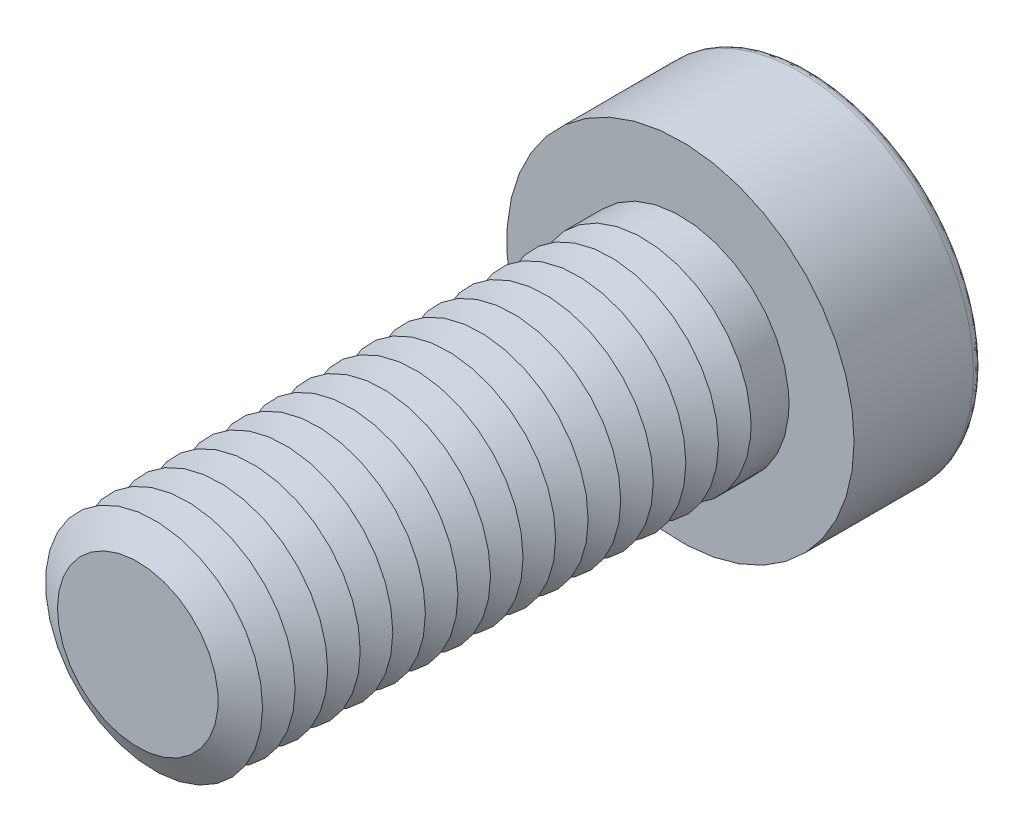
SolidWorks part; units mm, degrees
ref_plane "Front Plane" through (0, 0, 0) normal (0, 0, 1) x (1, 0, 0)
ref_plane "Top Plane" through (0, 0, 0) normal (0, 1, 0) x (1, 0, 0)
ref_plane "Right Plane" through (0, 0, 0) normal (1, 0, 0) x (0, 0, -1)
sketch "Sketch1" plane through (0, 0, 0) normal (0, 0, 1) x (1, 0, 0)
  circle A0 centre (0, 0) radius 5
  dimension "D1" = 10
extrude "Boss-Extrude1" add sketch "Sketch1" along normal blind 25
sketch "Sketch2" plane through (0, 0, 0) normal (0, 0, -1) x (-1, 0, 0)
  circle A0 centre (0, 0) radius 8
  dimension "D1" = 16
extrude "Boss-Extrude2" add sketch "Sketch2" along normal blind 6
sketch "Sketch3" plane through (0, 0, -6) normal (0, 0, -1) x (-1, 0, 0)
  line L1 (-2.0207, 3.5) -> (-4.0415, 0)
  line L2 (-4.0415, 0) -> (-2.0207, -3.5)
  line L3 (-2.0207, -3.5) -> (2.0207, -3.5)
  line L4 (2.0207, -3.5) -> (4.0415, 0)
  line L5 (4.0415, 0) -> (2.0207, 3.5)
  line L6 (2.0207, 3.5) -> (-2.0207, 3.5)
  circle A0 centre (0, 0) radius 3.5 construction
  dimension "D1" = 7
extrude "Cut-Extrude1" cut sketch "Sketch3" against normal blind 5.25
fillet "Fillet1" radius 0.5 1 edges at (-8, 0, -6)
sketch "Sketch4" plane through (0, 0, -0.75) normal (0, 0, -1) x (-1, 0, 0)
  line L0 (2.0207, -3.5) -> (4.0415, 0) construction
  circle A0 centre (0, 0) radius 3.5
extrude "Cut-Extrude2" cut sketch "Sketch4" against normal through all draft 60
sketch "Sketch5" plane through (0, 0, -6) normal (0, 0, -1) x (-1, 0, 0)
  circle A0 centre (0, 0) radius 4.0415
extrude "Cut-Extrude3" cut sketch "Sketch5" against normal through all draft 75
sketch "Sketch7" plane through (0, 0, 0) normal (1, 0, 0) x (0, 0, -1)
  line L25 (-25, 3.701) -> (-24.25, 5)
  line L26 (-25, 5) -> (-25, -5) construction
  line L27 (-24.25, 5) -> (-25.75, 5)
  line L28 (-25.75, 5) -> (-25, 3.701)
  line L29 (0, 5) -> (-25, 5) construction
  dimension "D1" = 1.5
revolve "Cut-Revolve1" cut sketch "Sketch7" angle 360 about axis through (0, 0, 25) along (0, 0, -1)
pattern_linear "LPattern1" count 16 spacing 1.5 along (0, 0, -1) of "Cut-Revolve1"
